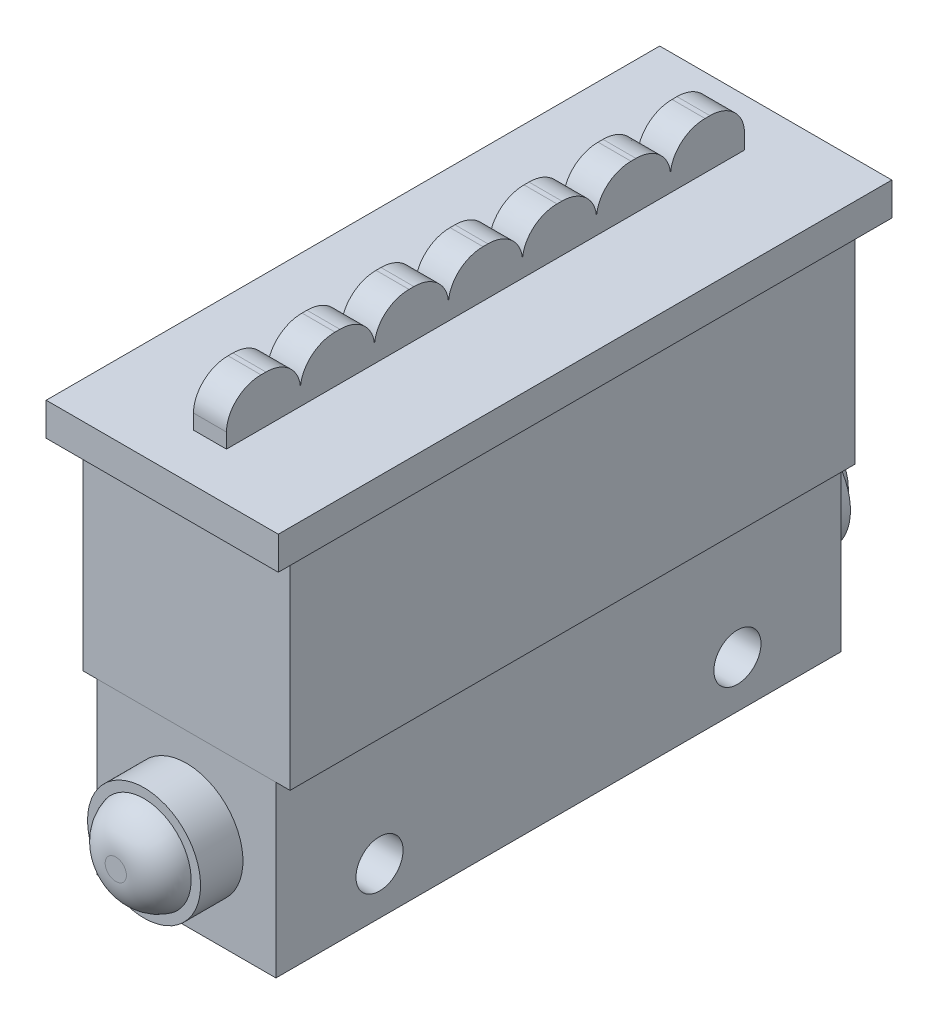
SolidWorks part; units mm, degrees
ref_plane "Front Plane" through (0, 0, 0) normal (0, 0, 1) x (1, 0, 0)
ref_plane "Top Plane" through (0, 0, 0) normal (0, 1, 0) x (1, 0, 0)
ref_plane "Right Plane" through (0, 0, 0) normal (1, 0, 0) x (0, 0, -1)
sketch "Sketch1" plane through (0, 0, 0) normal (1, 0, 0) x (0, 0, -1)
  line L1 (0, 0) -> (50, 0)
  line L2 (0, 0) -> (0, 22)
  line L3 (0, 22) -> (50, 22)
  line L4 (50, 11) -> (50, 22)
  line L5 (50, 0) -> (60, 0)
  line L7 (50, 11) -> (59, 11)
  line L8 (60, 0) -> (60, 10)
  arc A0 (59, 11) -> (60, 10) centre (59, 10) cw
  dimension "D1" = 1
extrude "Boss-Extrude1" add sketch "Sketch1" along normal mid plane 22
sketch "Sketch2" plane through (0, 22, 0) normal (0, 1, 0) x (1, 0, 0)
  line L8 (-6, 45) -> (-6, 5)
  line L9 (-6, 5) -> (6, 5)
  line L10 (6, 5) -> (6, 45)
  line L11 (6, 45) -> (-6, 45)
  line L12 (-6, 45) -> (-6, 5)
  line L13 (-6, 5) -> (6, 5)
  line L14 (6, 5) -> (6, 45)
  line L15 (6, 45) -> (-6, 45)
  dimension "D1" = 5
extrude "Cut-Extrude1" cut sketch "Sketch2" against normal through all
sketch "Sketch3" plane through (0, 0, 0) normal (1, 0, 0) x (0, 0, -1)
  line L0 (0, 0) -> (0, -13) construction
  line L1 (0, 0) -> (60, 0)
  line L2 (0, 0) -> (0, -18)
  line L3 (0, -18) -> (60, -18)
  line L4 (60, 0) -> (60, -18)
  line L5 (0, -13) -> (11, -13) construction
  line L6 (60, 0) -> (60, -13) construction
  line L7 (60, -13) -> (49, -13) construction
  circle A0 centre (11, -13) radius 2.5
  circle A1 centre (49, -13) radius 2.5
extrude "Boss-Extrude2" add sketch "Sketch3" along normal mid plane 19 separate body
sketch "Sketch4" plane through (0, 0, -60) normal (0, 0, -1) x (-1, 0, 0)
  circle A0 centre (0, -9) radius 6
extrude "Boss-Extrude3" add sketch "Sketch4" along normal blind 4.5 separate body
sketch "Sketch5" plane through (0, 0, -64.5) normal (0, 0, -1) x (-1, 0, 0)
  circle A0 centre (0, -9) radius 5
extrude "Boss-Extrude4" add sketch "Sketch5" along normal blind 3 separate body
fillet "Fillet1" radius 4 1 edges at (-5, -9, -67.5)
ref_plane "Plane1" through (0, 0, -30) normal (0, 0, 1) x (1, 0, 0)
mirror "Mirror1" about plane through (0, 0, -30) normal (0, 0, 1)
sketch "Sketch6" plane through (0, 0, 0) normal (1, 0, 0) x (0, 0, -1)
  line L0 (30, -13) -> (30, -20) construction
  circle A0 centre (11, -13) radius 2
  circle A1 centre (49, -13) radius 2
delete or keep bodies "Body-Delete/Keep 1" type delete bodies bodies 102
sketch "Sketch7" plane through (0, 0, 0) normal (1, 0, 0) x (0, 0, -1)
  line L1 (0, 0) -> (60, 0)
  line L2 (0, 0) -> (0, 22)
  line L3 (0, 22) -> (60, 22)
  line L4 (60, 0) -> (60, 22)
extrude "Boss-Extrude5" add sketch "Sketch7" along normal mid plane 22 separate body
sketch "Sketch9" plane through (0, 22, 0) normal (0, 1, 0) x (1, 0, 0)
  line L1 (-12.321, -2.5683) -> (12.321, -2.5683)
  line L2 (-12.321, -2.5683) -> (-12.321, 62.5683)
  line L3 (-12.321, 62.5683) -> (12.321, 62.5683)
  line L4 (12.321, -2.5683) -> (12.321, 62.5683)
  line L5 (-12.321, -2.5683) -> (12.321, 62.5683) construction
  line L6 (-12.321, 62.5683) -> (12.321, -2.5683) construction
  line L7 (-1.75, 2.5) -> (1.75, 2.5)
  line L8 (-1.75, 2.5) -> (-1.75, 57.5)
  line L9 (-1.75, 57.5) -> (1.75, 57.5)
  line L10 (1.75, 2.5) -> (1.75, 57.5)
  line L11 (-1.75, 2.5) -> (1.75, 57.5) construction
  line L12 (-1.75, 57.5) -> (1.75, 2.5) construction
  point P0 (0, 30)
  point P5 (0, 30)
extrude "Boss-Extrude7" add sketch "Sketch9" along normal blind 3.5 separate body
sketch "Sketch10" plane through (-1.75, 0, 0) normal (1, 0, 0) x (0, 0, -1)
  line L0 (6.1668, 30.5) -> (6.6906, 30.5)
  line L1 (14.0239, 30.5) -> (14.5477, 30.5)
  line L2 (21.8811, 30.5) -> (22.4048, 30.5)
  line L3 (29.7382, 30.5) -> (30.262, 30.5)
  line L4 (37.5954, 30.5) -> (38.1191, 30.5)
  line L5 (45.4525, 30.5) -> (45.9763, 30.5)
  line L6 (53.3096, 30.5) -> (53.8334, 30.5)
  spline S0 degree 3 poles (10.3572, 27.0737) (10.3572, 28.9581) (8.7072, 30.5) (6.6906, 30.5) knots 0 0 0 0 0.037037 0.037037 0.037037 0.037037
  spline S1 degree 3 poles (6.1668, 30.5) (4.1501, 30.5) (2.5, 28.9581) (2.5, 27.0737) knots 0.074074 0.074074 0.074074 0.074074 0.111111 0.111111 0.111111 0.111111
  spline S2 degree 2 poles (2.5, 27.0737) (2.5, 27.0737) (2.5, 25.5) knots 0.111111 0.111111 0.111111 0.148148 0.148148 0.148148
  spline S3 degree 2 poles (2.5, 25.5) (2.5, 25.5) (2.5, 22) knots 0.148148 0.148148 0.148148 0.185185 0.185185 0.185185
  spline S4 degree 2 poles (2.5, 22) (2.5, 22) (57.5001, 22) knots 0.185185 0.185185 0.185185 0.222222 0.222222 0.222222
  spline S5 degree 2 poles (57.5001, 22) (57.5001, 22) (57.5001, 25.5) knots 0.222222 0.222222 0.222222 0.259259 0.259259 0.259259
  spline S6 degree 2 poles (57.5001, 25.5) (57.5001, 25.5) (57.5001, 27.0737) knots 0.259259 0.259259 0.259259 0.296296 0.296296 0.296296
  spline S7 degree 3 poles (57.5001, 27.0737) (57.5001, 28.9581) (55.8501, 30.5) (53.8334, 30.5) knots 0.296296 0.296296 0.296296 0.296296 0.333333 0.333333 0.333333 0.333333
  spline S8 degree 3 poles (53.3096, 30.5) (51.293, 30.5) (49.6429, 28.9581) (49.6429, 27.0737) knots 0.37037 0.37037 0.37037 0.37037 0.407407 0.407407 0.407407 0.407407
  spline S9 degree 3 poles (49.6429, 27.0737) (49.6429, 28.9581) (47.9929, 30.5) (45.9763, 30.5) knots 0.407407 0.407407 0.407407 0.407407 0.444444 0.444444 0.444444 0.444444
  spline S10 degree 3 poles (45.4525, 30.5) (43.4358, 30.5) (41.7858, 28.9581) (41.7858, 27.0737) knots 0.481481 0.481481 0.481481 0.481481 0.518519 0.518519 0.518519 0.518519
  spline S11 degree 3 poles (41.7858, 27.0737) (41.7858, 28.9581) (40.1358, 30.5) (38.1191, 30.5) knots 0.518519 0.518519 0.518519 0.518519 0.555556 0.555556 0.555556 0.555556
  spline S12 degree 3 poles (37.5954, 30.5) (35.5787, 30.5) (33.9286, 28.9581) (33.9286, 27.0737) knots 0.592593 0.592593 0.592593 0.592593 0.62963 0.62963 0.62963 0.62963
  spline S13 degree 3 poles (33.9286, 27.0737) (33.9286, 28.9581) (32.2786, 30.5) (30.262, 30.5) knots 0.62963 0.62963 0.62963 0.62963 0.666667 0.666667 0.666667 0.666667
  spline S14 degree 3 poles (29.7382, 30.5) (27.7216, 30.5) (26.0715, 28.9581) (26.0715, 27.0737) knots 0.703704 0.703704 0.703704 0.703704 0.740741 0.740741 0.740741 0.740741
  spline S15 degree 3 poles (26.0715, 27.0737) (26.0715, 28.9581) (24.4215, 30.5) (22.4048, 30.5) knots 0.740741 0.740741 0.740741 0.740741 0.777778 0.777778 0.777778 0.777778
  spline S16 degree 3 poles (21.8811, 30.5) (19.8644, 30.5) (18.2143, 28.9581) (18.2143, 27.0737) knots 0.814815 0.814815 0.814815 0.814815 0.851852 0.851852 0.851852 0.851852
  spline S17 degree 3 poles (18.2143, 27.0737) (18.2143, 28.9581) (16.5644, 30.5) (14.5477, 30.5) knots 0.851852 0.851852 0.851852 0.851852 0.888889 0.888889 0.888889 0.888889
  spline S18 degree 3 poles (14.0239, 30.5) (12.0073, 30.5) (10.3572, 28.9581) (10.3572, 27.0737) knots 0.925926 0.925926 0.925926 0.925926 1 1 1 1
extrude "Boss-Extrude8" add sketch "Sketch10" along normal blind 3.5 separate body
